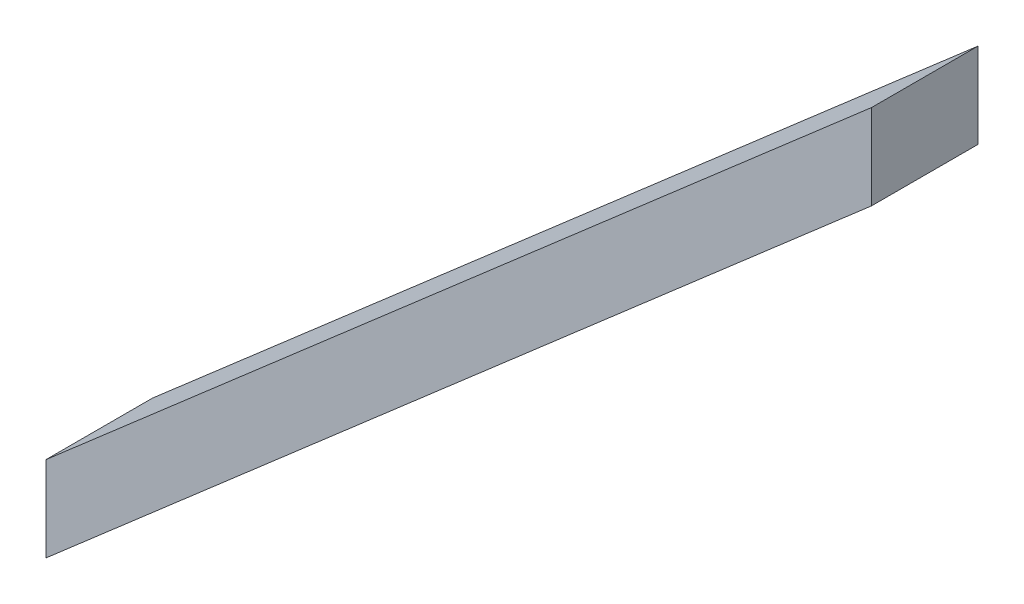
SolidWorks part; units mm, degrees
ref_plane "Front Plane" through (0, 0, 0) normal (0, 0, 1) x (1, 0, 0)
ref_plane "Top Plane" through (0, 0, 0) normal (0, 1, 0) x (1, 0, 0)
ref_plane "Right Plane" through (0, 0, 0) normal (1, 0, 0) x (0, 0, -1)
sketch "Sketch1" plane through (0, 0, 0) normal (0, 0, 1) x (1, 0, 0)
  line L0 (0, 0) -> (0, 50.3505)
  line L1 (0, 50.3505) -> (488, 474.5624)
  line L2 (488, 474.5624) -> (488, 424.2119)
  line L3 (488, 424.2119) -> (0, 0)
  dimension "D1" = 38
  dimension "D2" = 49
  dimension "D3" = 488
extrude "Boss-Extrude1" add sketch "Sketch1" along normal blind 63 contours L1 L2 L3 L0
